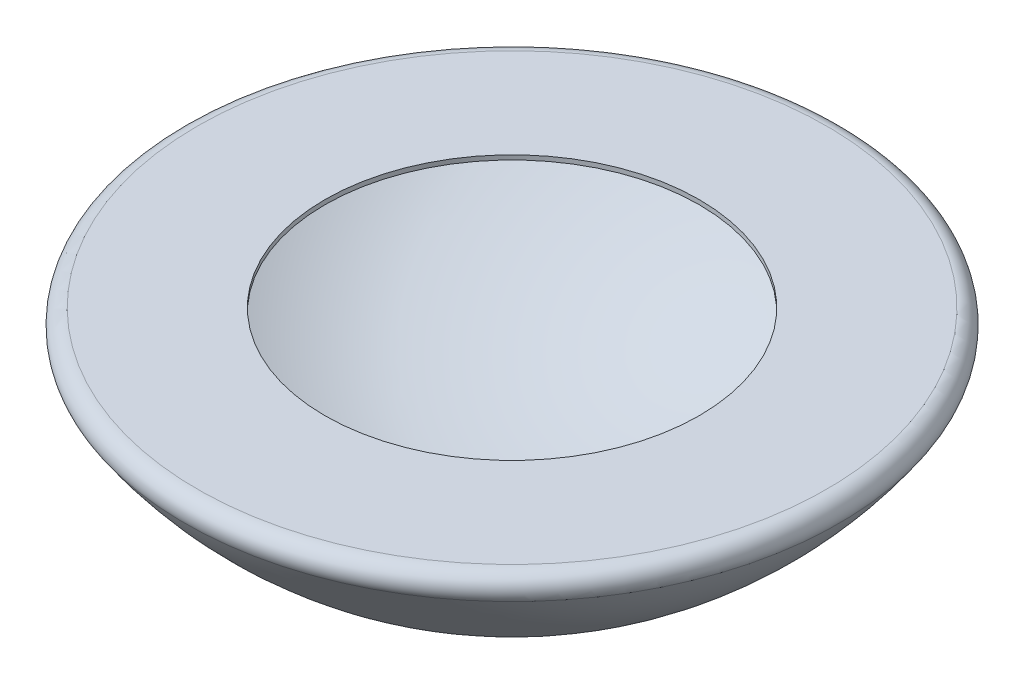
SolidWorks part; units mm, degrees
ref_plane "Plan de face" through (0, 0, 0) normal (0, 0, 1) x (1, 0, 0)
ref_plane "Plan de dessus" through (0, 0, 0) normal (0, 1, 0) x (1, 0, 0)
ref_plane "Plan de droite" through (0, 0, 0) normal (1, 0, 0) x (0, 0, -1)
sketch "Esquisse1" plane through (0, 0, 0) normal (0, 0, 1) x (1, 0, 0)
  line L0 (21, -0.3) -> (12.495, -0.3)
  line L1 (21, 0) -> (12.495, 0)
  line L2 (12.495, 0) -> (12.495, -0.3)
  line L3 (0, -13) -> (0, -12.7)
  line L5 (0, 4.2807) -> (0, -15.11) construction
  arc A0 (0, -12.7) -> (21.58, -1.392) centre (0.2866, 12.9984) ccw
  arc A1 (0, -13) -> (21.8285, -1.5599) centre (0.2866, 12.9984) ccw
  arc A2 (21.8285, -1.5599) -> (21, 0) centre (21, -1) ccw
  arc A3 (21.58, -1.392) -> (21, -0.3) centre (21, -1) ccw
  arc A4 (0.0033, -12.7) -> (21.58, -1.392) centre (0.2866, 12.9984) ccw construction
  dimension "D1" = 26
  dimension "D3" = 1
  dimension "D2" = 13
  dimension "D4" = 12.495
  dimension "D5" = 21
  dimension "D6" = 0.3
revolve "Révolution2" add sketch "Esquisse1" angle 360 about L5
